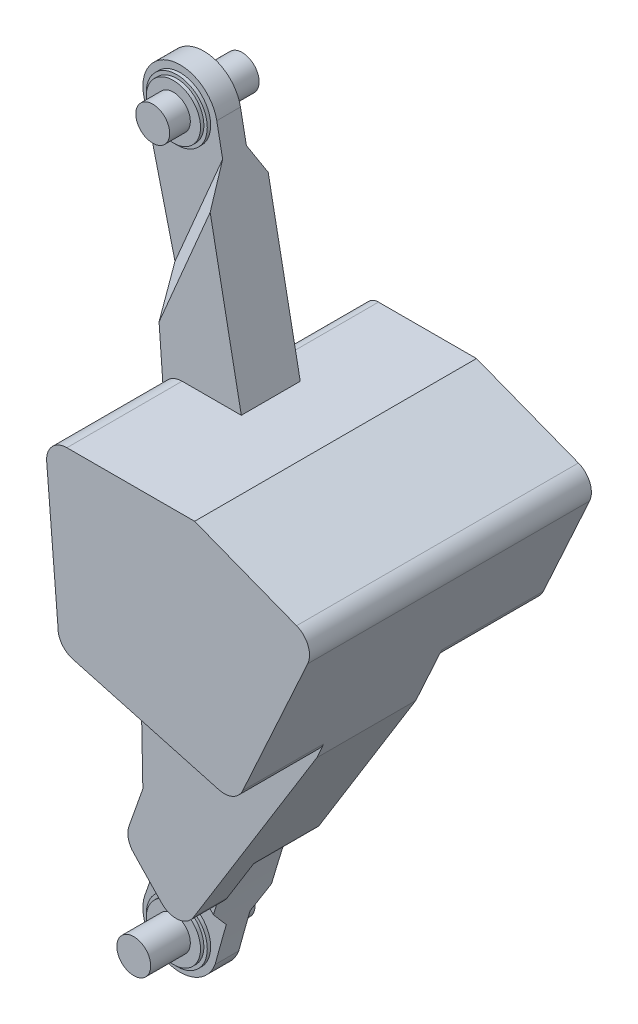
SolidWorks part; units mm, degrees
ref_plane "Piano1 (Front/Back)" through (0, 0, 0) normal (0, 0, 1) x (1, 0, 0)
ref_plane "Piano2 (Top/Bottom)" through (0, 0, 0) normal (0, 1, 0) x (1, 0, 0)
ref_plane "Piano3 (Left/Right)" through (0, 0, 0) normal (1, 0, 0) x (0, 0, -1)
imported_body "Importato1"
sketch "Schizzo1" plane through (35.0447, 0.6117, 0) normal (-0.9998, -0.0175, 0) x (0, 0, 1)
  line L4 (58.4945, 304.3894) -> (58.4945, 454.3894)
  line L5 (58.4945, 454.3894) -> (8.4945, 454.3894)
  line L6 (8.4945, 454.3894) -> (8.4945, 304.3894)
  line L7 (8.4945, 304.3894) -> (58.4945, 304.3894)
  line L8 (58.4945, 304.3894) -> (58.4945, 454.3894)
  line L9 (58.4945, 454.3894) -> (8.4945, 454.3894)
  line L10 (8.4945, 454.3894) -> (8.4945, 304.3894)
  line L11 (8.4945, 304.3894) -> (58.4945, 304.3894)
  dimension "D1" = 0
extrude "Taglio-Estrusione1" cut sketch "Schizzo1" against normal blind 20
